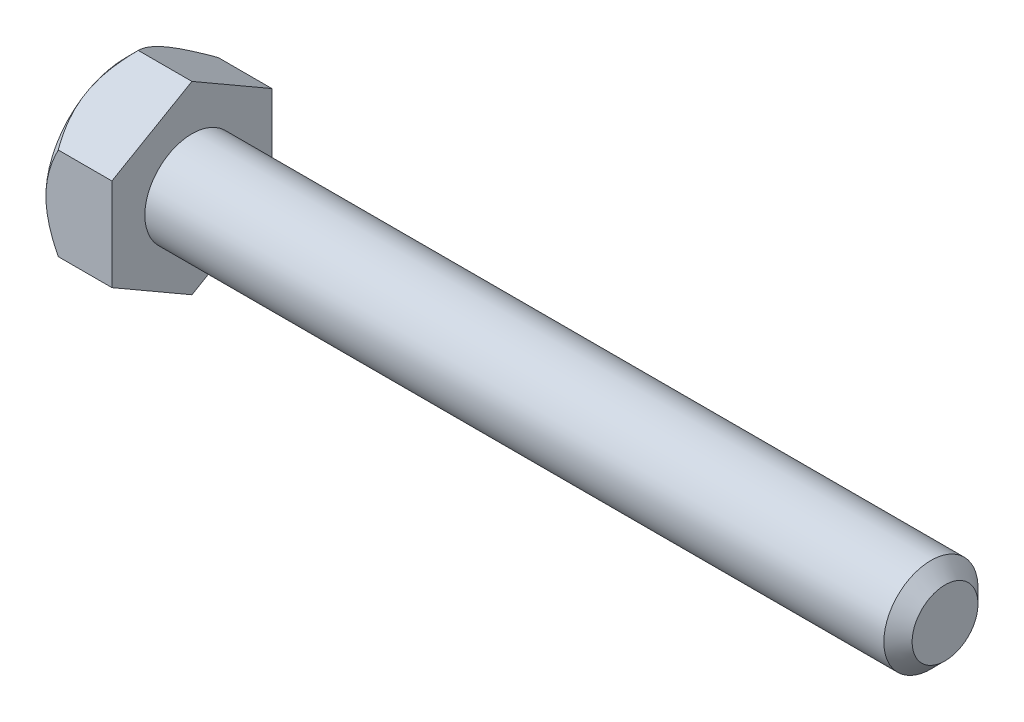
SolidWorks part; units mm, degrees
ref_plane "Plan1" through (0, 0, 0) normal (0, 0, 1) x (1, 0, 0)
ref_plane "Plan2" through (0, 0, 0) normal (0, 1, 0) x (1, 0, 0)
ref_plane "Plan3" through (0, 0, 0) normal (1, 0, 0) x (0, 0, -1)
sketch "Esquisse1" plane through (0, 0, 0) normal (0, 0, 1) x (1, 0, 0)
  line L0 (-49.2335, 0) -> (51.0797, 0) construction
  line L1 (-7, 0) -> (-7, 9.815)
  line L2 (-7, 9.815) -> (0, 9.815)
  line L3 (0, 9.815) -> (0, 5)
  line L4 (0, 5) -> (80, 5)
  line L5 (80, 5) -> (80, 0)
  line L6 (-7, 0) -> (80, 0)
  dimension "D1" = 5
  dimension "D2" = 7
  dimension "D3" = 7
  dimension "D4" = 80
  dimension "D5" = 9.815
revolve "Base-Révolution" add sketch "Esquisse1"
chamfer "Chanfrein2" distance 1.5 angle 45
chamfer "Chanfrein1" distance 1.3 angle 45
sketch "Esquisse2" plane through (-7, 0, 0) normal (-1, 0, 0) x (0, 0, 1)
  line L5 (-8.5, 4.9075) -> (0, 9.815)
  line L6 (0, 9.815) -> (8.5, 4.9075)
  line L7 (8.5, 4.9075) -> (8.5, -4.9075)
  line L8 (0, -9.815) -> (8.5, -4.9075)
  line L9 (-8.5, -4.9075) -> (0, -9.815)
  line L10 (-8.5, 4.9075) -> (-8.5, -4.9075)
  dimension "D1" = 17
extrude "Enlèv. mat.-Extru.1" cut sketch "Esquisse2" against normal through all flip side to cut
